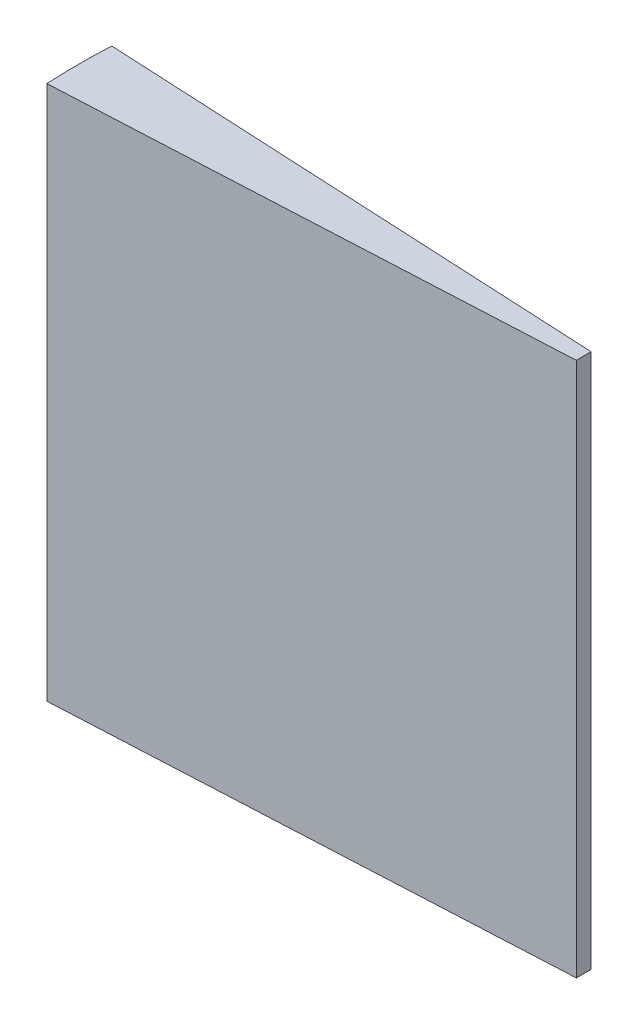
SolidWorks part; units mm, degrees
ref_plane "Front Plane" through (0, 0, 0) normal (0, 0, 1) x (1, 0, 0)
ref_plane "Top Plane" through (0, 0, 0) normal (0, 1, 0) x (1, 0, 0)
ref_plane "Right Plane" through (0, 0, 0) normal (1, 0, 0) x (0, 0, -1)
sketch "Sketch1" plane through (0, 0, 0) normal (0, 0, 1) x (1, 0, 0)
  line L0 (0, 0) -> (0, 88.9688) construction
  line L1 (-31.75, 0) -> (-139.7, 0)
  line L2 (-31.75, 0) -> (-31.75, 114.3)
  line L3 (-31.75, 114.3) -> (-139.7, 114.3)
  line L4 (0, 0) -> (-28.575, 0) construction
  line L5 (0, 0) -> (-158.7543, 0) construction
  line L6 (-139.7, 0) -> (-139.7, 114.3)
  dimension "D1" = 139.7
  dimension "D2" = 114.3
  dimension "D3" = 63.5
revolve "Revolve1" add sketch "Sketch1" angle 5.7 mid plane about L0
sketch "Sketch2" plane through (0, 114.3, 0) normal (0, 1, 0) x (1, 0, 0)
  line L0 (-31.3971, 4.7203) -> (-138.1474, 20.7695)
  line L1 (-31.7107, 1.5787) -> (-139.5272, 6.9461)
  arc A0 (-138.1474, 20.7695) -> (-139.5272, 6.9461) centre (0, 0) ccw
  arc A1 (-31.3971, 4.7203) -> (-31.7107, 1.5787) centre (0, 0) ccw
  dimension "D1" = 5.7
extrude "Boss-Extrude1" [suppressed] add sketch "Sketch2" against normal up to surface (114.3 mm away) separate body
sketch "Sketch4" [suppressed] plane through (0, 114.3, 0) normal (0, 1, 0) x (1, 0, 0)
  line L0 (-31.7107, 1.5787) -> (-139.5272, 6.9461)
  line L1 (-31.0388, 6.6825) -> (-136.5707, 29.4029)
  arc A0 (-136.5707, 29.4029) -> (-139.5272, 6.9461) centre (0, 0) ccw
  arc A1 (-31.0388, 6.6825) -> (-31.7107, 1.5787) centre (0, 0) ccw
  dimension "D1" = 9.3
extrude "Boss-Extrude2" [suppressed] add sketch "Sketch4" against normal up to surface (114.3 mm away) separate body
